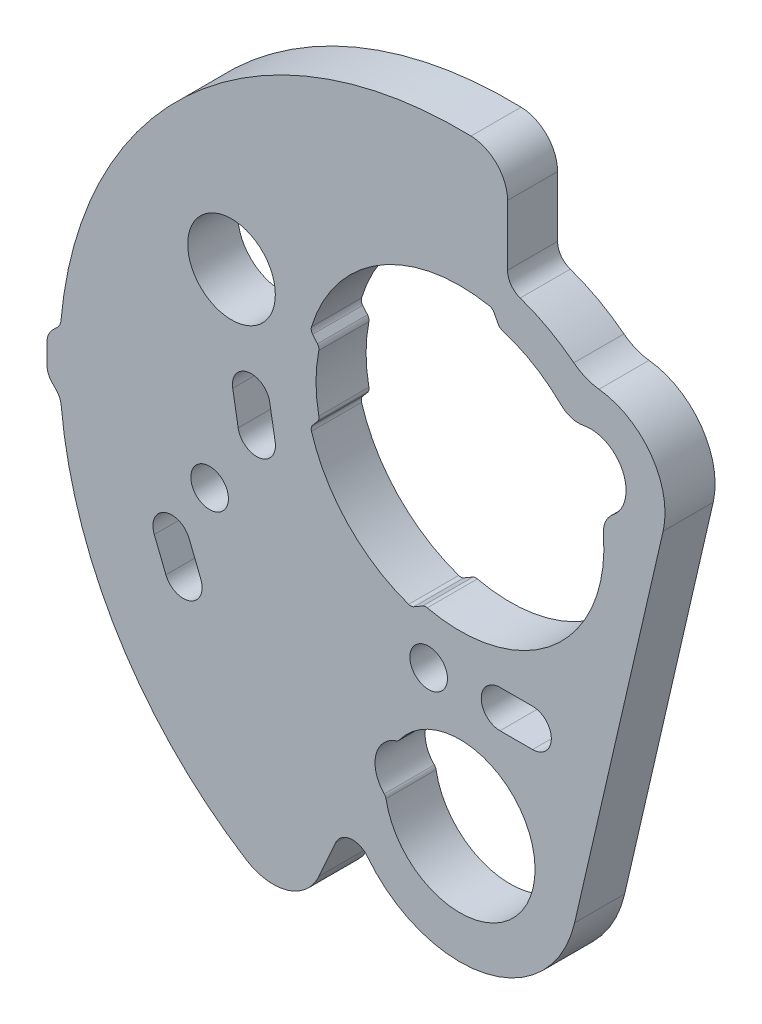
SolidWorks part; units mm, degrees
ref_plane "Piano frontale" through (0, 0, 0) normal (0, 0, 1) x (1, 0, 0)
ref_plane "Piano superiore" through (0, 0, 0) normal (0, 1, 0) x (1, 0, 0)
ref_plane "Piano destro" through (0, 0, 0) normal (1, 0, 0) x (0, 0, -1)
sketch "Schizzo3" plane through (0, 0, 0) normal (0, 0, 1) x (1, 0, 0)
  line L0 (0, 0) -> (0, -16.2) construction
  line L2 (0, 0) -> (0, 8.8) construction
  circle A3 centre (0, 0) radius 33.5
  circle A4 centre (0, 8.8) radius 11.5
  circle A5 centre (0, -16.2) radius 6
  dimension "D3" = 67
  dimension "D4" = 23
  dimension "D5" = 12
  dimension "D1" = 8.8
  dimension "D2" = 25
sketch "Schizzo2" plane through (0, 0, 0) normal (0, 0, 1) x (1, 0, 0)
  line L0 (2227.7386, 2548.5957) -> (2402.6831, 2548.5957) construction
sketch "Schizzo4" plane through (0, 0, 0) normal (0, 0, 1) x (1, 0, 0)
  line L0 (0, 0) -> (0, 8.8) construction
  line L1 (0, 0) -> (0, -16.2) construction
  circle A0 centre (0, 8.8) radius 11.5
  dimension "D1" = 23
sketch "Schizzo5" plane through (0, 0, 0) normal (0, 0, 1) x (1, 0, 0)
  line L0 (-32.5508, 1.8482) -> (-32.1612, 2.2378)
  line L1 (-32.5508, -1.8482) -> (-32.289, -2.1101)
  line L2 (-8.7462, -19.6443) -> (0, 0) construction
  line L3 (16.2314, 12.319) -> (9.1591, -18.3145)
  line L4 (0, 0) -> (0, -16.2) construction
  line L5 (-11.2718, -25.3169) -> (-9.94, -22.3256)
  line L6 (3.8, 28.989) -> (3.8, 24.1614)
  line L7 (0, 8.8) -> (10.4225, 13.6601) construction
  line L8 (0, 0) -> (0, 8.8) construction
  line L9 (0, 0) -> (-38, 0) construction
  line L10 (-11.7668, 11.9457) -> (-11.3816, 11.4866)
  line L11 (-11.7668, 5.6543) -> (-11.3816, 6.1134)
  line L12 (-3.6836, -2.8641) -> (-2.9732, -2.4539)
  line L13 (2.7106, 20.7164) -> (3.0703, 20.0399)
  line L14 (0, 8.8) -> (-13, 8.8) construction
  line L15 (0, -16.2) -> (-4.2872, -15.2102) construction
  arc A0 (-31.8563, -3.0287) -> (-17.0583, -27.0742) centre (0, 0) ccw
  arc A1 (9.1007, 20.4077) -> (4.8108, 22.7434) centre (0, 8.8) ccw
  arc A2 (-7.3904, -22.0088) -> (9.1591, -18.3145) centre (0, -16.2) ccw
  arc A3 (-32.9897, 0.825) -> (-32.9897, -0.825) centre (0, 0) ccw
  arc A4 (-11.862, 5.1873) -> (-4.0989, -2.903) centre (0, 8.8) ccw
  arc A5 (0.8828, 31.9878) -> (-31.8723, 2.8556) centre (0, 0) ccw
  arc A6 (16.2314, 12.319) -> (11.1085, 19.5822) centre (10.4225, 13.6601) ccw
  arc A7 (3.8, 28.989) -> (0.8828, 31.9878) centre (0.8, 28.989) ccw
  arc A8 (-11.2718, -25.3169) -> (-17.0583, -27.0742) centre (-14.926, -23.69) cw
  arc A9 (-7.3904, -22.0088) -> (-9.94, -22.3256) centre (-8.5697, -22.9357) ccw
  arc A10 (11.1085, 19.5822) -> (9.1007, 20.4077) centre (11.5687, 23.5556) cw
  arc A11 (4.8108, 22.7434) -> (3.8, 24.1614) centre (5.3, 24.1614) cw
  arc A12 (-31.8723, 2.8556) -> (-32.1612, 2.2378) centre (-32.8683, 2.9449) cw
  arc A13 (-32.5508, 1.8482) -> (-32.9897, 0.825) centre (-31.4902, 0.7875) ccw
  arc A14 (-32.5508, -1.8482) -> (-32.9897, -0.825) centre (-31.4902, -0.7875) cw
  arc A15 (-31.8563, -3.0287) -> (-32.289, -2.1101) centre (-33.3496, -3.1707) ccw
  arc A16 (-11.2744, 11.0667) -> (-11.2744, 6.5333) centre (0, 8.8) ccw
  arc A17 (12.2057, 11.4368) -> (9.8656, 16.4552) centre (10.4225, 13.6601) ccw
  arc A18 (2.3644, 20.9725) -> (-11.862, 12.4127) centre (0, 8.8) ccw
  arc A19 (-2.6097, -2.4) -> (11.4634, 9.7171) centre (0, 8.8) ccw
  arc A20 (8.0711, 16.9919) -> (3.3654, 19.7965) centre (0, 8.8) ccw
  arc A21 (-5.9068, -17.2532) -> (-4.8473, -12.664) centre (0, -16.2) ccw
  arc A22 (12.2057, 11.4368) -> (11.4634, 9.7171) centre (13.457, 9.8767) ccw
  arc A23 (9.8656, 16.4552) -> (8.0711, 16.9919) centre (9.4748, 18.4166) cw
  arc A24 (-11.862, 12.4127) -> (-11.7668, 11.9457) centre (-11.3837, 12.2671) ccw
  arc A25 (-11.3816, 11.4866) -> (-11.2744, 11.0667) centre (-11.7646, 11.1652) cw
  arc A26 (-11.7668, 5.6543) -> (-11.862, 5.1873) centre (-11.3837, 5.3329) ccw
  arc A27 (-11.2744, 6.5333) -> (-11.3816, 6.1134) centre (-11.7646, 6.4348) cw
  arc A28 (-2.6097, -2.4) -> (-2.9732, -2.4539) centre (-2.7232, -2.8869) ccw
  arc A29 (-4.0989, -2.903) -> (-3.6836, -2.8641) centre (-3.9336, -2.4311) ccw
  arc A30 (2.7106, 20.7164) -> (2.3644, 20.9725) centre (2.2691, 20.4817) ccw
  arc A31 (3.3654, 19.7965) -> (3.0703, 20.0399) centre (3.5117, 20.2747) cw
  arc A32 (-5.0906, -12.8428) -> (-6.0471, -16.9858) centre (-4.2872, -15.2102) ccw
  arc A33 (-5.9068, -17.2532) -> (-6.0471, -16.9858) centre (-6.3991, -17.341) ccw
  arc A34 (-4.8473, -12.664) -> (-5.0906, -12.8428) centre (-5.2513, -12.3693) cw
  point P39 (-32.969, 1.43)
  point P42 (-32.969, -1.43)
  point P59 (8.9073, 16.0739)
  point P66 (-11.225, 11.3)
  point P71 (-11.225, 6.3)
  point P74 (-2.8, -2.3539)
  point P79 (2.6, 20.9244)
  dimension "D1" = 29.5
  dimension "D2" = 66
  dimension "D3" = 64
  dimension "D4" = 9.4
  dimension "D15" = 3
  dimension "D16" = 4
  dimension "D17" = 1.5
  dimension "D18" = 4
  dimension "D19" = 1.5
  dimension "D20" = 1
  dimension "D21" = 1.5
  dimension "D22" = 1.5
  dimension "D23" = 1.5
  dimension "D24" = 23
  dimension "D25" = 5.7
  dimension "D26" = 24.8
  dimension "D27" = 12
  dimension "D28" = 2
  dimension "D29" = 2
  dimension "D39" = 0.5
  dimension "D40" = 0.5
  dimension "D41" = 0.5
  dimension "D42" = 0.5
  dimension "D43" = 0.5
  dimension "D44" = 0.5
  dimension "D45" = 0.5
  dimension "D46" = 0.5
  dimension "D49" = 5
  dimension "D50" = 0.5
  dimension "D51" = 0.5
  dimension "D5" = 24
  dimension "D6" = 13
  dimension "D7" = 11.5
  dimension "D8" = 115
  dimension "D9" = 3.8
  dimension "D10" = 38
  dimension "D11" = 1.43
  dimension "D12" = 1.43
  dimension "D13" = 45
  dimension "D14" = 45
  dimension "D30" = 13
  dimension "D31" = 2.5
  dimension "D32" = 2.5
  dimension "D33" = 50
  dimension "D34" = 50
  dimension "D35" = 2.8
  dimension "D36" = 120
  dimension "D37" = 2.6
  dimension "D38" = 28
  dimension "D47" = 4.4
  dimension "D48" = 77
extrude "Estrusione-Estrusione1" add sketch "Schizzo5" against normal blind 4
sketch "Schizzo7" plane through (0, 0, 0) normal (0, 0, 1) x (1, 0, 0)
  line L0 (3.2, -6.5) -> (5.8, -6.5) construction
  line L1 (3.2, -5) -> (5.8, -5)
  line L2 (3.2, -8) -> (5.8, -8)
  line L3 (0, 0) -> (3.9146, 0) construction
  line L4 (3.2, -6.5) -> (-2.5, -6.5) construction
  line L5 (0, 0) -> (0, 8.8) construction
  line L6 (-16.24, 2.75) -> (-16.6757, 5.2726) construction
  line L8 (-17.7181, 2.4947) -> (-18.1538, 5.0173)
  line L9 (-14.7619, 3.0053) -> (-15.1976, 5.528)
  line L10 (-23.0284, -7.6788) -> (-22.1, -10) construction
  line L11 (-21.6357, -7.1217) -> (-20.7073, -9.4429)
  line L12 (-24.4211, -8.2358) -> (-23.4927, -10.5571)
  arc A0 (3.2, -5) -> (3.2, -8) centre (3.2, -6.5) ccw
  arc A1 (5.8, -8) -> (5.8, -5) centre (5.8, -6.5) ccw
  circle A2 centre (-2.5, -6.5) radius 1.5
  arc A3 (-17.7181, 2.4947) -> (-14.7619, 3.0053) centre (-16.24, 2.75) ccw
  arc A4 (-15.1976, 5.528) -> (-18.1538, 5.0173) centre (-16.6757, 5.2726) ccw
  circle A5 centre (-20, -2.8) radius 1.5
  arc A6 (-21.6357, -7.1217) -> (-24.4211, -8.2358) centre (-23.0284, -7.6788) ccw
  arc A7 (-23.4927, -10.5571) -> (-20.7073, -9.4429) centre (-22.1, -10) ccw
  circle A8 centre (-18.25, 13.2) radius 3.5
  point P2 (4.5, -6.5)
  point P18 (-16.4579, 4.0113)
  point P27 (-22.5642, -8.8394)
  dimension "D2" = 1.5
  dimension "D4" = 3
  dimension "D10" = 1.5
  dimension "D12" = 3
  dimension "D15" = 1.5
  dimension "D20" = 7
  dimension "D1" = 6.5
  dimension "D3" = 2.6
  dimension "D5" = 5.7
  dimension "D6" = 3.2
  dimension "D7" = 2.75
  dimension "D8" = 16.24
  dimension "D9" = 2.56
  dimension "D11" = 9.8
  dimension "D13" = 2.8
  dimension "D14" = 20
  dimension "D16" = 2.5
  dimension "D17" = 10
  dimension "D18" = 22.1
  dimension "D19" = 21.8
  dimension "D21" = 18.25
  dimension "D22" = 13.2
extrude "Taglio-Estrusione1" cut sketch "Schizzo7" against normal through all
